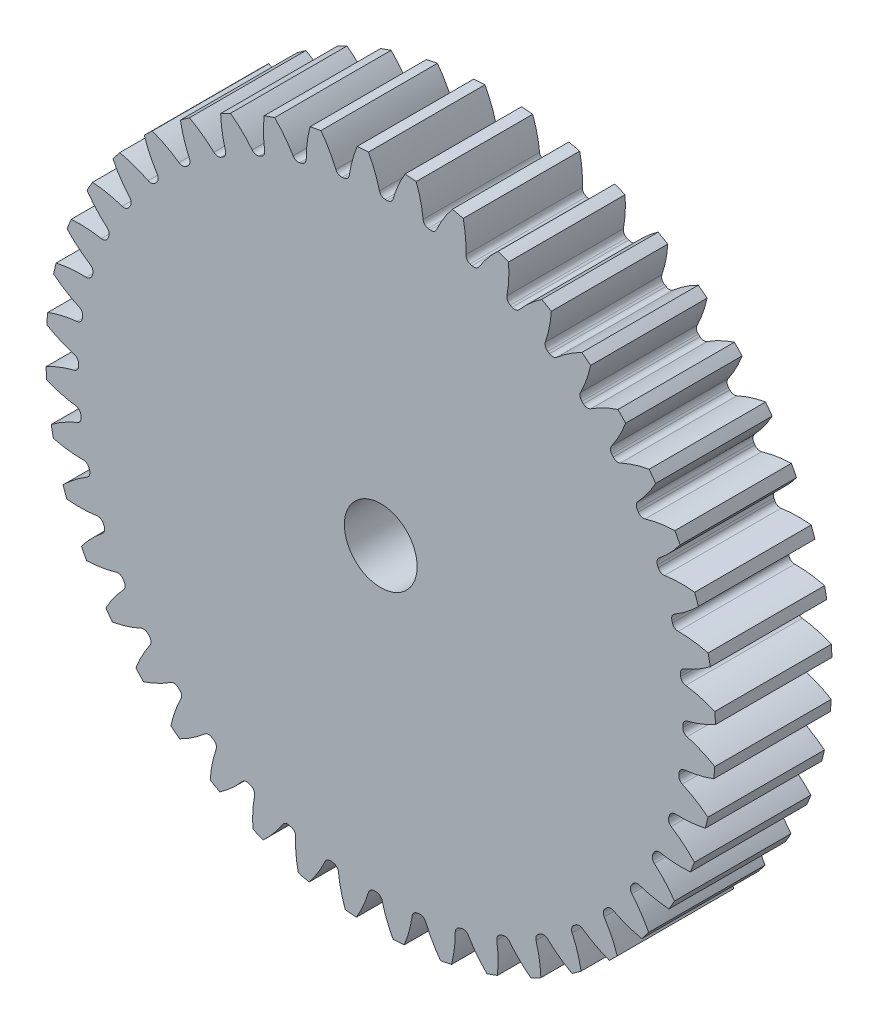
SolidWorks part; units mm, degrees
ref_plane "Front" through (0, 0, 0) normal (0, 0, 1) x (1, 0, 0)
ref_plane "Top" through (0, 0, 0) normal (0, 1, 0) x (1, 0, 0)
ref_plane "Right" through (0, 0, 0) normal (1, 0, 0) x (0, 0, -1)
sketch "Sketch3" plane through (0, 0, 0) normal (0, 0, 1) x (1, 0, 0)
  circle A0 centre (0, 0) radius 292.1
  dimension "od" = 584.2
extrude "gearBody" add sketch "Sketch3" along normal blind 101.6
sketch "Sketch2" plane through (0, 0, 0) normal (0, 0, 1) x (1, 0, 0)
  line L0 (0, 0) -> (242.5647, 100.4736) construction
  line L1 (291.5219, -21.3399) -> (0, 0) construction
  line L2 (0, 0) -> (36.3143, 0) construction
  line L3 (279.3566, 4.9221) -> (279, -14.9451) construction
  line L5 (279.1783, -5.0115) -> (0, 0) construction
  line L7 (0, 0) -> (262.5501, 0) construction
  arc A0 (262.5501, 0.0529) -> (262.3791, -9.4758) centre (0, 0) ccw construction
  arc A1 (291.902, 10.7542) -> (291.3279, -21.2237) centre (0, 0) ccw construction
  arc A2 (279.3566, 4.9221) -> (279, -14.9451) centre (0, 0) ccw construction
  arc A3 (263.4641, -5.6635) -> (263.4977, -3.7959) centre (0, 0) ccw
  arc A4 (291.5219, -21.3399) -> (267.1983, -10.7408) centre (238.8024, -109.1146) ccw
  arc A5 (291.5219, -21.3399) -> (292.1, 10.8634) centre (0, 0) ccw
  arc A6 (292.1, 10.8634) -> (267.4117, 1.144) centre (242.5647, 100.4736) cw
  arc A7 (263.4977, -3.7959) -> (267.4117, 1.144) centre (268.666, -3.8704) cw
  arc A8 (267.1983, -10.7408) -> (263.4641, -5.6635) centre (268.6318, -5.7746) cw
  point P6 (292.1, 10.8634)
  point P22 (291.5219, -21.3399)
  dimension "baseDia" = 525.1002
  dimension "od" = 584.2
  dimension "pd" = 558.8
  dimension "rd" = 527.05
  dimension "rFillet" = 5.1689
  dimension "pointX" = 292.1
  dimension "pointY" = 10.8634
  dimension "CTT" = 19.8672
  dimension "flankCenterAngle" = 22.5
extrude "toothCut" cut sketch "Sketch2" along normal through all
pattern_circular "CirPattern1" count 44 over 360 about axis through (0, 0, 0) along (0, 0, 1) of "toothCut"
sketch "hub1Dia" plane through (0, 0, 0) normal (0, 0, -1) x (-1, 0, 0)
  circle A0 centre (0, 0) radius 12.7
  dimension "hub1Dia" = 25.4
sketch "hub2Dia" plane through (0, 0, 101.6) normal (0, 0, 1) x (1, 0, 0)
  circle A0 centre (0, 0) radius 12.7
  dimension "hub2dia" = 25.4
sketch "boreDia" plane through (0, 0, 0) normal (0, 0, 1) x (1, 0, 0)
  circle A0 centre (0, 0) radius 31.75
  dimension "boreDia" = 63.5
extrude "bore" cut sketch "boreDia" against normal mid plane 25400
